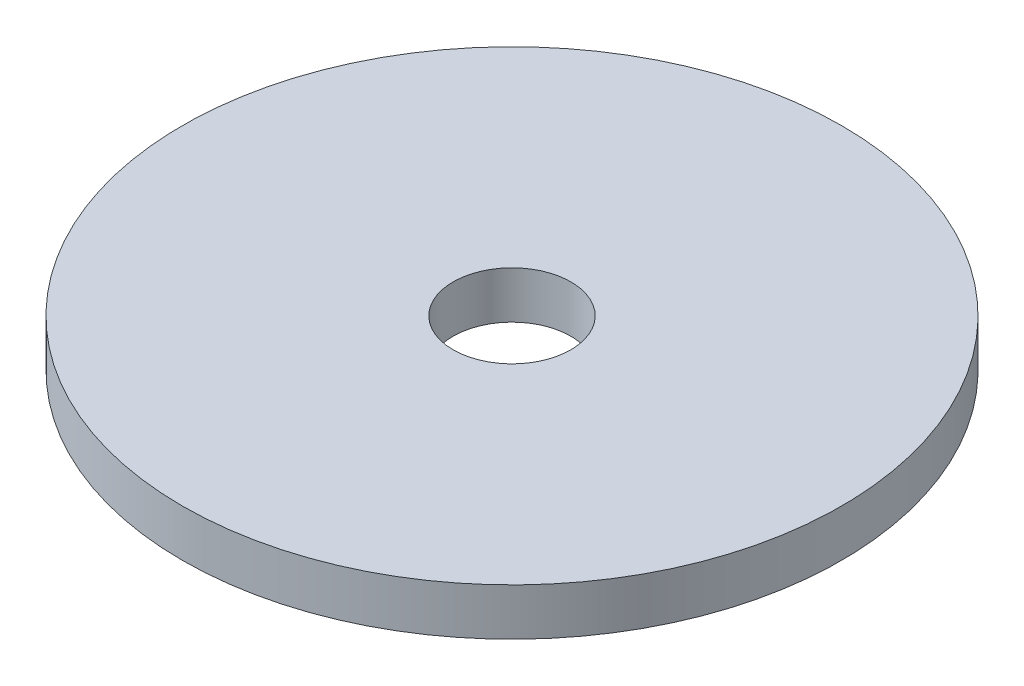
SolidWorks part; units mm, degrees
ref_plane "Front Plane" through (0, 0, 0) normal (0, 0, 1) x (1, 0, 0)
ref_plane "Top Plane" through (0, 0, 0) normal (0, 1, 0) x (1, 0, 0)
ref_plane "Right Plane" through (0, 0, 0) normal (1, 0, 0) x (0, 0, -1)
sketch "Sketch1" plane through (0, 0, 0) normal (0, 0, 1) x (1, 0, 0)
  line L0 (0, 0) -> (0, -5.5296) construction
  line L1 (2.5, 0) -> (14, 0)
  line L2 (2.5, 0) -> (2.5, 2)
  line L3 (2.5, 2) -> (14, 2)
  line L4 (14, 0) -> (14, 2)
  dimension "D1" = 2
  dimension "D2" = 5
  dimension "D3" = 28
revolve "Revolve1" add sketch "Sketch1" angle 360 about L0
